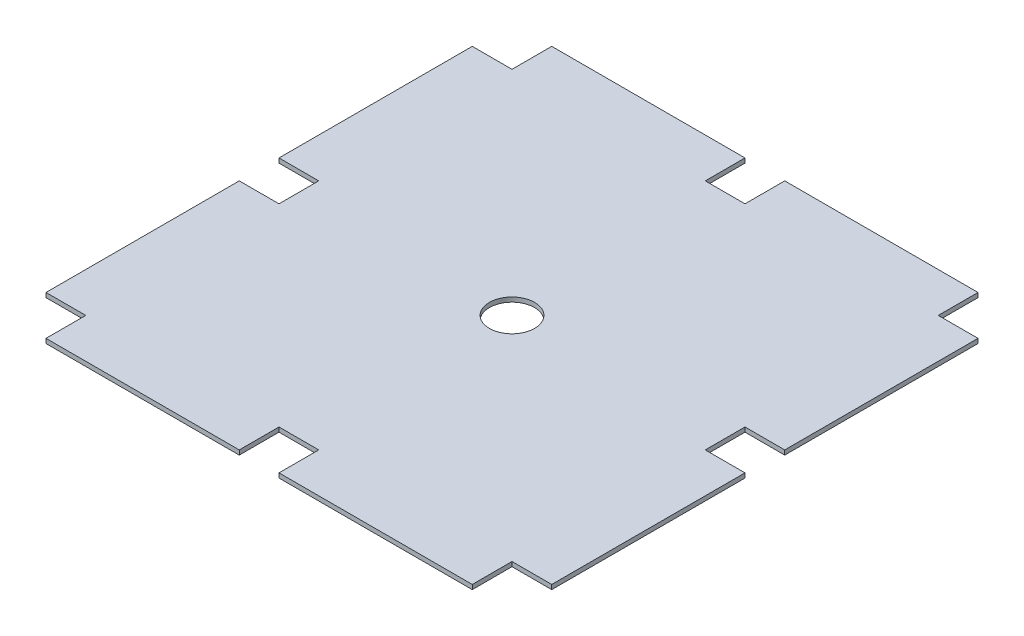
SolidWorks part; units mm, degrees
ref_plane "Front Plane" through (0, 0, 0) normal (0, 0, 1) x (1, 0, 0)
ref_plane "Top Plane" through (0, 0, 0) normal (0, 1, 0) x (1, 0, 0)
ref_plane "Right Plane" through (0, 0, 0) normal (1, 0, 0) x (0, 0, -1)
sketch "Sketch1" plane through (0, 0, 0) normal (0, 1, 0) x (1, 0, 0)
  line L0 (-177.8, 0) -> (177.8, 0) construction
  line L1 (-177.8, -177.8) -> (177.8, -177.8)
  line L2 (-177.8, -177.8) -> (-177.8, 177.8)
  line L3 (-177.8, 177.8) -> (177.8, 177.8)
  line L4 (177.8, -177.8) -> (177.8, 177.8)
  line L5 (-177.8, -177.8) -> (177.8, 177.8) construction
  line L6 (-177.8, 177.8) -> (177.8, -177.8) construction
  line L7 (177.8, -149.86) -> (149.86, -149.86)
  line L8 (-177.8, 177.8) -> (-149.86, 177.8)
  line L9 (-177.8, 177.8) -> (-177.8, 149.86)
  line L10 (-177.8, 149.86) -> (-149.86, 149.86)
  line L11 (-149.86, 177.8) -> (-149.86, 149.86)
  line L12 (177.8, 177.8) -> (149.86, 177.8)
  line L13 (177.8, 177.8) -> (177.8, 149.86)
  line L14 (177.8, 149.86) -> (149.86, 149.86)
  line L15 (149.86, 177.8) -> (149.86, 149.86)
  line L16 (149.86, -177.8) -> (149.86, -149.86)
  line L17 (-177.8, -149.86) -> (-149.86, -149.86)
  line L18 (-149.86, -177.8) -> (-149.86, -149.86)
  line L19 (0, -177.8) -> (0, 177.8) construction
  line L20 (149.86, -13.97) -> (177.8, -13.97)
  line L21 (-177.8, 13.97) -> (-149.86, 13.97)
  line L22 (-177.8, 13.97) -> (-177.8, -13.97)
  line L23 (-177.8, -13.97) -> (-149.86, -13.97)
  line L24 (-149.86, 13.97) -> (-149.86, -13.97)
  line L25 (-177.8, 13.97) -> (-149.86, -13.97) construction
  line L26 (-177.8, -13.97) -> (-149.86, 13.97) construction
  line L27 (-13.97, -149.86) -> (13.97, -149.86)
  line L28 (-13.97, -149.86) -> (-13.97, -177.8)
  line L29 (-13.97, -177.8) -> (13.97, -177.8)
  line L30 (13.97, -149.86) -> (13.97, -177.8)
  line L31 (-13.97, -149.86) -> (13.97, -177.8) construction
  line L32 (-13.97, -177.8) -> (13.97, -149.86) construction
  line L33 (149.86, 13.97) -> (149.86, -13.97)
  line L34 (149.86, 13.97) -> (177.8, 13.97)
  line L35 (13.97, 177.8) -> (13.97, 149.86)
  line L36 (-13.97, 177.8) -> (-13.97, 149.86)
  line L37 (-13.97, 149.86) -> (13.97, 149.86)
  circle A0 centre (0, 0) radius 15.875
  point P0 (0, 0)
  point P24 (-163.83, 0)
  point P29 (0, -163.83)
  dimension "D3" = 31.75
  dimension "D1" = 355.6
  dimension "D2" = 355.6
  dimension "D4" = 27.94
  dimension "D5" = 27.94
  dimension "D6" = 27.94
  dimension "D7" = 27.94
  dimension "D8" = 27.94
  dimension "D9" = 27.94
extrude "Boss-Extrude1" add sketch "Sketch1" along normal blind 3.175 contours L18 L1 L16 L7 L4 L14 L15 L3 L11 L10 L2 L17 A0
